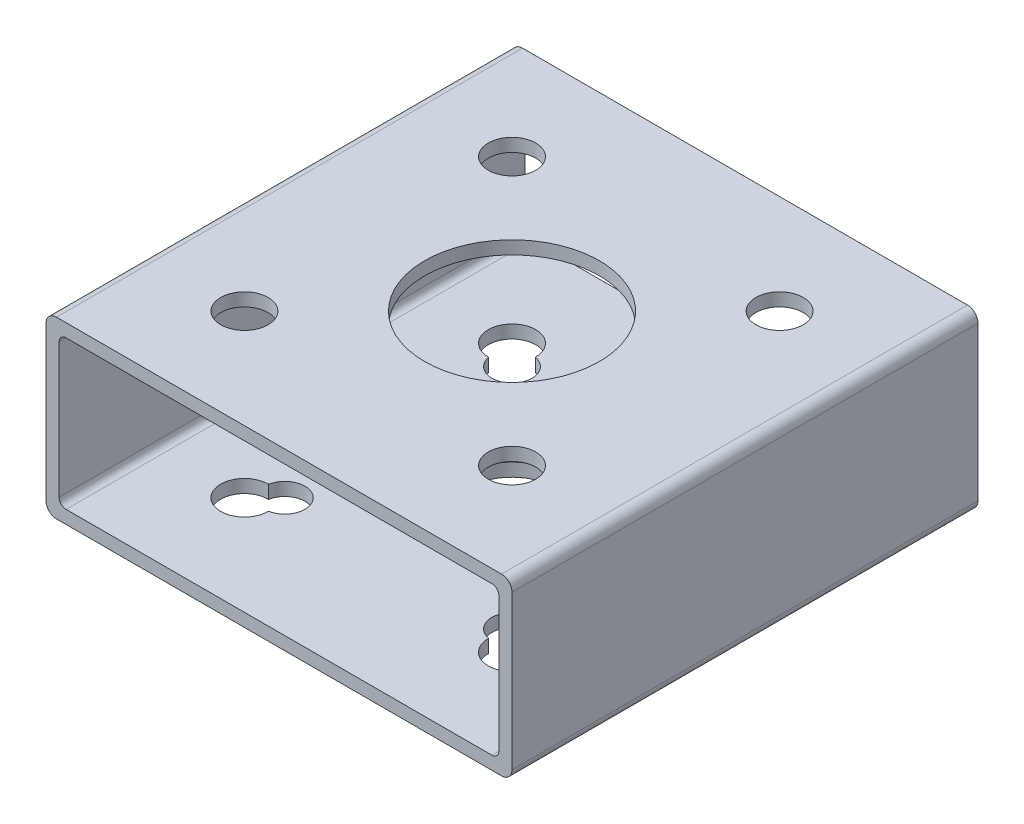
SolidWorks part; units mm, degrees
ref_plane "front" through (0, 0, 0) normal (0, 0, 1) x (1, 0, 0)
ref_plane "Plane2" through (0, 0, 0) normal (0, 1, 0) x (1, 0, 0)
ref_plane "Plane3" through (0, 0, 0) normal (1, 0, 0) x (0, 0, -1)
sketch "Sketch1" plane through (0, 0, 0) normal (0, 0, 1) x (1, 0, 0)
  line L0 (0, 0) -> (0, 76.2)
  line L1 (0, 76.2) -> (203.2, 76.2)
  line L2 (203.2, 76.2) -> (203.2, 0)
  line L3 (203.2, 0) -> (0, 0)
  dimension "D1" = 76.2
  dimension "D2" = 203.2
extrude "Base-Extrude-Thin" add sketch "Sketch1" against normal blind 203.2 thin
fillet "Fillet2" radius 3.048 4 edges at (197.485, 5.715, -101.6) (5.715, 5.715, -101.6) (5.715, 70.485, -101.6) (197.485, 70.485, -101.6)
fillet "Fillet3" radius 4.572 4 edges at (0, 0, -101.6) (0, 76.2, -101.6) (203.2, 76.2, -101.6) (203.2, 0, -101.6)
sketch "Sketch2" plane through (0, 76.2, 0) normal (0, 1, 0) x (-1, 0, 0)
  line L0 (-101.6, -203.2) -> (-101.6, 0) construction
  line L1 (-198.628, -101.6) -> (-4.572, -101.6) construction
  line L2 (-101.6, -101.6) -> (-43.2637, -159.9363) construction
  line L3 (-4.572, 0) -> (-198.628, 0) construction
  line L4 (-4.572, -203.2) -> (-198.628, -203.2) construction
  line L5 (-4.572, 0) -> (-4.572, -203.2) construction
  line L6 (-198.628, -203.2) -> (-198.628, 0) construction
  circle A0 centre (-101.6, -101.6) radius 38.1
  circle A1 centre (-159.9363, -159.9363) radius 10.3251
  circle A2 centre (-43.2637, -159.9363) radius 10.3251
  circle A3 centre (-159.9363, -43.2637) radius 10.3251
  circle A4 centre (-43.2637, -43.2637) radius 10.3251
  circle A5 centre (-101.6, -101.6) radius 82.5 construction
  point P10 (-101.6, -125.73)
  point P13 (-101.6, -26.67)
  dimension "D3" = 76.2
  dimension "D8" = 20.6502
  dimension "D4" = 165
  dimension "D5" = 45
extrude "ACTUATOR" cut sketch "Sketch2" against normal blind 5.715
sketch "Sketch6" plane through (0, 0, 0) normal (0, -1, 0) x (1, 0, 0)
  line L0 (4.572, -101.6) -> (198.628, -101.6) construction
  line L1 (4.572, 0) -> (4.572, -203.2) construction
  line L2 (198.628, -203.2) -> (198.628, 0) construction
  line L3 (101.6, 0) -> (101.6, -203.2) construction
  line L4 (4.572, 0) -> (198.628, 0) construction
  line L5 (4.572, -203.2) -> (198.628, -203.2) construction
  line L7 (52.07, -52.07) -> (151.13, -52.07) construction
  line L8 (52.07, -52.07) -> (52.07, -151.13) construction
  line L9 (52.07, -151.13) -> (151.13, -151.13) construction
  line L10 (151.13, -52.07) -> (151.13, -151.13) construction
  circle A0 centre (101.6, -101.6) radius 19.05
  circle A1 centre (52.07, -52.07) radius 8.763
  circle A2 centre (52.07, -151.13) radius 8.763
  circle A3 centre (151.13, -52.07) radius 8.763
  circle A4 centre (151.13, -151.13) radius 8.763
  dimension "D1" = 38.1
  dimension "D3" = 17.526
  dimension "D2" = 99.06
extrude "BF VALVE" cut sketch "Sketch6" against normal blind 5.715
sketch "Sketch7" plane through (0, 0, 0) normal (0, -1, 0) x (1, 0, 0)
  circle A0 centre (43.2637, -159.9363) radius 10.3251 construction
  circle A1 centre (159.9363, -159.9363) radius 10.3251 construction
  circle A2 centre (159.9363, -43.2637) radius 10.3251 construction
  circle A3 centre (43.2637, -43.2637) radius 10.3251 construction
  circle A4 centre (43.2637, -159.9363) radius 10.3251
  circle A5 centre (159.9363, -159.9363) radius 10.3251
  circle A6 centre (159.9363, -43.2637) radius 10.3251
  circle A7 centre (43.2637, -43.2637) radius 10.3251
extrude "ACT BOLT ACCESS" cut sketch "Sketch7" against normal blind 5.715
